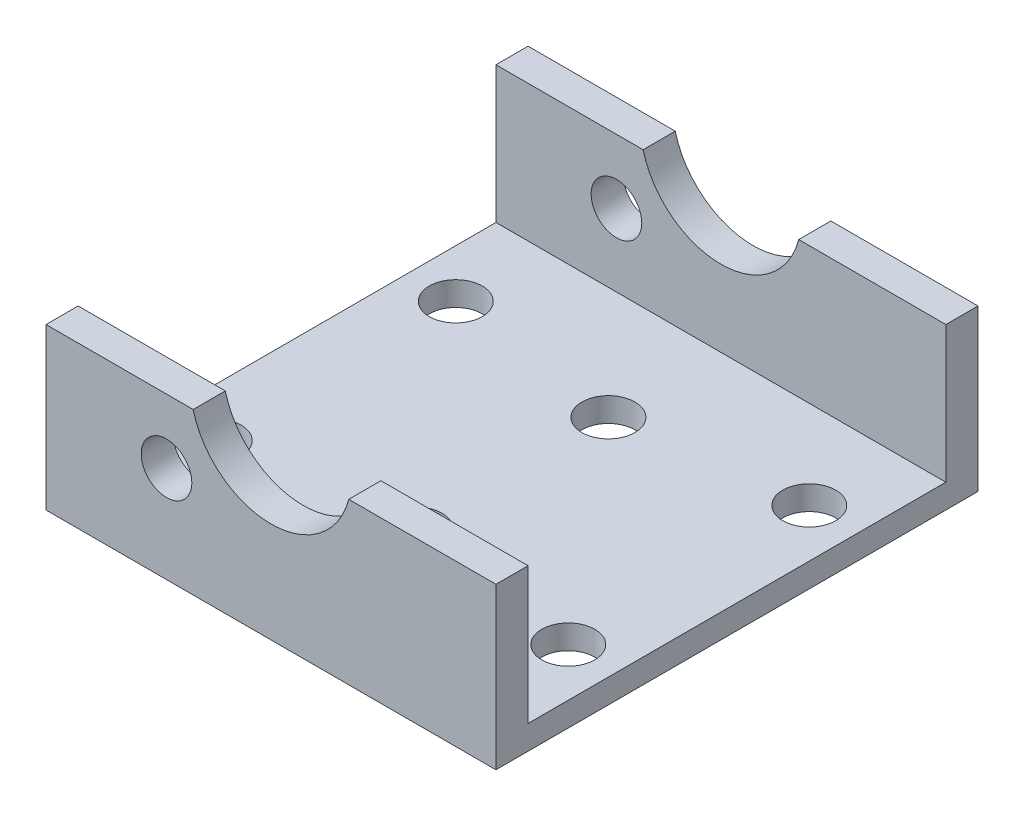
SolidWorks part; units mm, degrees
ref_plane "Plan de face" through (0, 0, 0) normal (0, 0, 1) x (1, 0, 0)
ref_plane "Plan de dessus" through (0, 0, 0) normal (0, 1, 0) x (1, 0, 0)
ref_plane "Plan de droite" through (0, 0, 0) normal (1, 0, 0) x (0, 0, -1)
sketch "Esquisse1" plane through (0, 0, 0) normal (0, 0, 1) x (1, 0, 0)
  line L0 (0, 31.2692) -> (0, -24.4701) construction
  line L1 (-28, 15) -> (28, 15)
  line L2 (-28, 15) -> (-28, 35)
  line L3 (-28, 35) -> (28, 35)
  line L4 (28, 15) -> (28, 35)
  line L6 (15, 15) -> (-15, 15) construction
  dimension "D1" = 56
  dimension "D2" = 20
extrude "Extrusion1" add sketch "Esquisse1" along normal mid plane 60
hole_wizard "Dégagement M61" positions "Esquisse3" profile "Esquisse4" hole size "M6" standard "ISO"
sketch "Esquisse3" plane through (0, 35, 0) normal (0, 1, 0) x (-1, 0, 0)
  line L0 (0, 26.894) -> (0, -21.7686) construction
  line L1 (0, 105) -> (0, -275) construction
  line L2 (-21.9588, 0) -> (24.8238, 0) construction
  line L3 (122.0716, 0) -> (-122.0716, 0) construction
  point P0 (22, 15)
  point P1 (22, -15)
  point P2 (-22, -15)
  point P3 (-22, 15)
  dimension "D1" = 30
  dimension "D2" = 44
sketch "Esquisse4" plane through (-22, 35, 15) normal (1, 0, 0) x (0, 0, 1)
  line L0 (0, 0) -> (0, 20)
  line L1 (0, 20) -> (3.3, 20)
  line L2 (3.3, 20) -> (3.3, 0)
  line L5 (3.3, 0) -> (0, 0)
  line L11 (0, -6.35) -> (0, 107.95) construction
  dimension "Diamètre du perçage jusqu'au prochain" = 6.6
  dimension "Profondeur du perçage jusqu'au prochain" = 20
sketch "Esquisse5" plane through (0, 0, 30) normal (0, 0, 1) x (1, 0, 0)
  circle A0 centre (0, 37.5) radius 10
  dimension "D1" = 20
  dimension "D2" = 37.5
extrude "Enlèv. mat.-Extru.1" cut sketch "Esquisse5" against normal through all
sketch "Esquisse6" plane through (-28, 0, 0) normal (-1, 0, 0) x (0, 0, 1)
  line L0 (30, 35) -> (-30, 35) construction
  line L1 (26, 35) -> (-26, 35)
  line L2 (26, 35) -> (26, 18)
  line L3 (26, 18) -> (-26, 18)
  line L4 (-26, 35) -> (-26, 18)
  line L6 (0, 0) -> (0, -73.581) construction
  line L7 (0, -122.0716) -> (0, 122.0716) construction
  line L9 (30, 15) -> (-30, 15) construction
  dimension "D1" = 52
  dimension "D2" = 3
extrude "Enlèv. mat.-Extru.2" cut sketch "Esquisse6" against normal through all
hole_wizard "Dégagement M62" positions "Esquisse8" profile "Esquisse7" hole size "M6" standard "ISO"
sketch "Esquisse8" plane through (0, 18, 0) normal (0, 1, 0) x (-1, 0, 0)
  line L0 (0, 105) -> (0, -275) construction
  line L2 (-35.5198, 0) -> (38.0279, 0) construction
  line L3 (9.6825, 26) -> (28, 26) construction
  line L4 (9.6825, -26) -> (28, -26) construction
  point P0 (0, 12)
  point P1 (0, -12)
  dimension "D1" = 24
sketch "Esquisse7" plane through (0, 18, 12) normal (1, 0, 0) x (0, 0, 1)
  line L0 (0, 0) -> (0, 3)
  line L1 (0, 3) -> (3.3, 3)
  line L2 (3.3, 3) -> (3.3, 0)
  line L5 (3.3, 0) -> (0, 0)
  line L11 (0, -6.35) -> (0, 107.95) construction
  dimension "Diamètre du perçage jusqu'au prochain" = 6.6
  dimension "Profondeur du perçage jusqu'au prochain" = 3
sketch "Esquisse9" plane through (0, 0, 30) normal (0, 0, 1) x (1, 0, 0)
  line L0 (-28, 35) -> (-28, 15) construction
  line L1 (-9.6825, 35) -> (-28, 35) construction
  circle A0 centre (-13, 27) radius 3.15
  dimension "D1" = 15
  dimension "D2" = 8
  dimension "D3" = 6.3
extrude "Enlèv. mat.-Extru.3" cut sketch "Esquisse9" against normal through all
sketch "Esquisse10" plane through (0, 0, -30) normal (0, 0, -1) x (-1, 0, 0)
  point P0 (13, 27)
sketch "Esquisse11" plane through (0, 0, 30) normal (0, 0, 1) x (1, 0, 0)
  point P0 (-13, 27)
